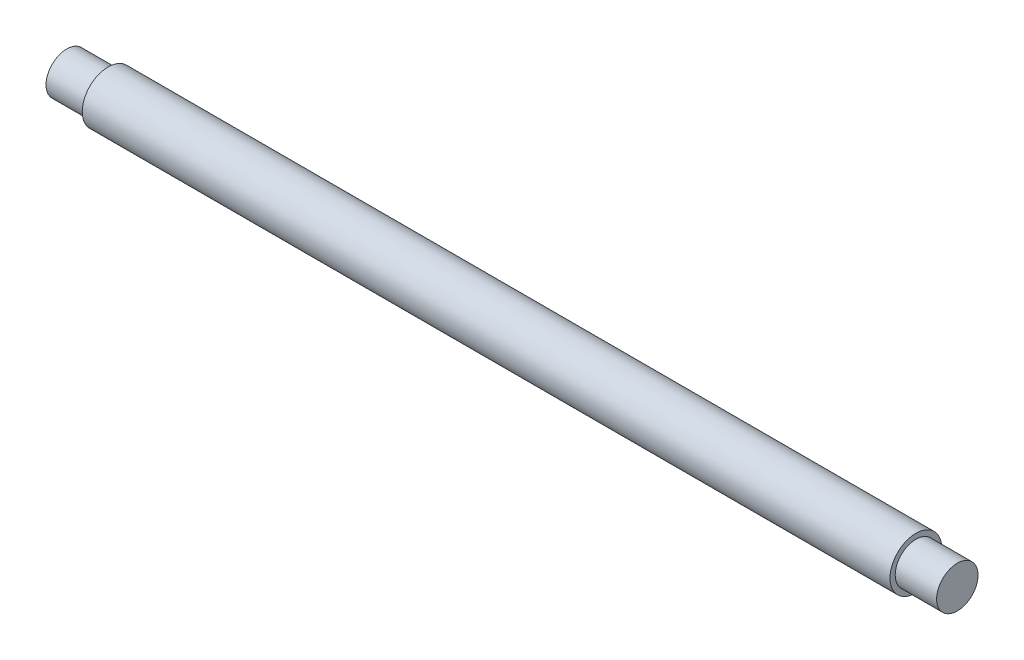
SolidWorks part; units mm, degrees
ref_plane "Front Plane" through (0, 0, 0) normal (0, 0, 1) x (1, 0, 0)
ref_plane "Top Plane" through (0, 0, 0) normal (0, 1, 0) x (1, 0, 0)
ref_plane "Right Plane" through (0, 0, 0) normal (1, 0, 0) x (0, 0, -1)
sketch "Sketch1" plane through (0, 0, 0) normal (0, 0, 1) x (1, 0, 0)
  line L0 (0, 0) -> (184.0672, 0) construction
  line L1 (0, 0) -> (0, 4)
  line L2 (0, 4) -> (8, 4)
  line L3 (8, 4) -> (8, 5)
  line L4 (8, 5) -> (164, 5)
  line L5 (164, 5) -> (164, 4)
  line L6 (164, 4) -> (172, 4)
  line L7 (172, 4) -> (172, 0)
  line L8 (172, 0) -> (0, 0)
  dimension "D1" = 8
  dimension "D2" = 10
  dimension "D3" = 172
  dimension "D4" = 8
revolve "Revolve1" add sketch "Sketch1" angle 360 about L0
